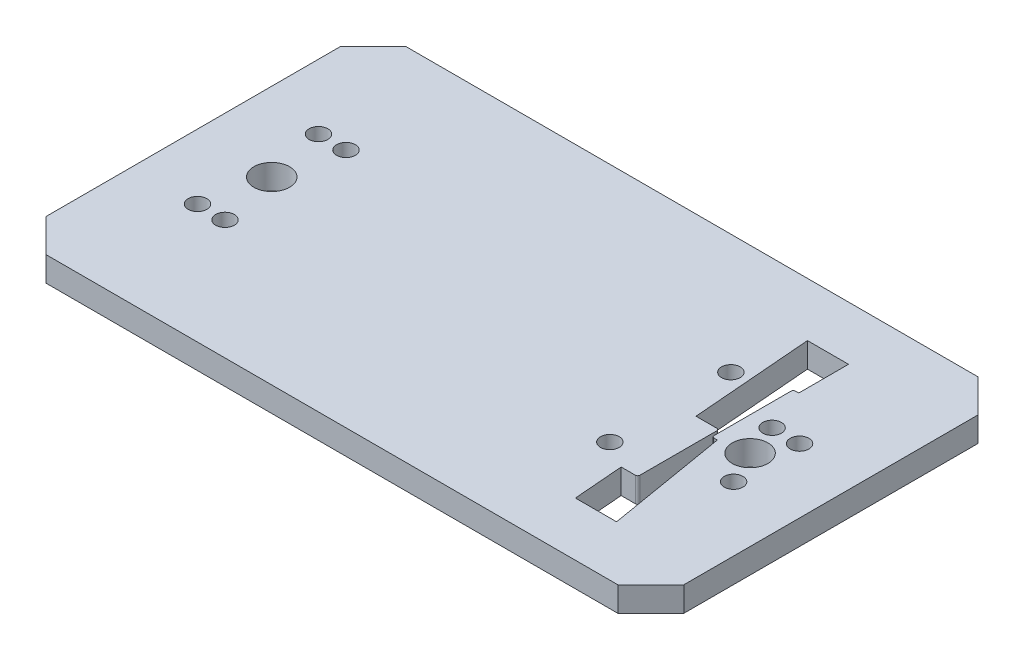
SolidWorks part; units mm, degrees
ref_plane "Front Plane" through (0, 0, 0) normal (0, 0, 1) x (1, 0, 0)
ref_plane "Top Plane" through (0, 0, 0) normal (0, 1, 0) x (1, 0, 0)
ref_plane "Right Plane" through (0, 0, 0) normal (1, 0, 0) x (0, 0, -1)
sketch "Sketch11" plane through (0, 0, 0) normal (0, 1, 0) x (1, 0, 0)
  line L0 (-47, 32.75) -> (-53, 26.75)
  line L1 (41.75, -13.5) -> (41.75, 0.5)
  line L2 (-53, 26.75) -> (-53, -26.75)
  line L3 (43.25, -0.9) -> (46.9663, -22.95)
  line L4 (-53, -26.75) -> (-47, -32.75)
  line L5 (38.7545, -13.9) -> (41.35, -13.9)
  line L7 (41.75, -26.75) -> (41.75, 26.75) construction
  line L8 (-47, -32.75) -> (57, -32.75)
  line L9 (57, -32.75) -> (63, -26.75)
  line L10 (63, -26.75) -> (63, 26.75)
  line L11 (63, 26.75) -> (57, 32.75)
  line L12 (57, 32.75) -> (-47, 32.75)
  line L13 (42.25, -0.5) -> (42.25, 13.5)
  line L14 (42.65, 13.9) -> (43.25, 13.9)
  line L15 (37.5612, 0.9) -> (35.7832, 22.95)
  line L17 (46.9663, -22.95) -> (39.4842, -22.95)
  line L18 (39.4842, -22.95) -> (38.7545, -13.9)
  line L19 (35.7832, 22.95) -> (43.25, 22.95)
  line L21 (42.25, -13.5) -> (42.25, 0.5) construction
  line L22 (41.35, 0.9) -> (37.5612, 0.9)
  line L23 (42.65, -0.9) -> (43.25, -0.9)
  line L24 (43.25, 13.9) -> (43.25, 22.95)
  line L26 (41.75, -13.5) -> (41.75, 0.5) construction
  arc A0 (42.65, -0.9) -> (42.25, -0.5) centre (42.65, -0.5) cw
  arc A1 (41.35, 0.9) -> (41.75, 0.5) centre (41.35, 0.5) cw
  circle A2 centre (-38.7, 0) radius 3.25
  arc A3 (41.75, -13.5) -> (41.35, -13.9) centre (41.35, -13.5) cw
  circle A4 centre (-41.2, 11) radius 1.7
  arc A5 (42.65, 13.9) -> (42.25, 13.5) centre (42.65, 13.5) ccw
  circle A6 centre (48.3, 0) radius 3.25
  circle A7 centre (-41.2, -11) radius 1.7
  circle A8 centre (-36.2, 11) radius 1.7
  circle A11 centre (-36.2, -11) radius 1.7
  circle A64 centre (33.8, 11) radius 1.7
  circle A67 centre (33.8, -11) radius 1.7
  circle A73 centre (46.3, 6) radius 1.7
  circle A77 centre (51.3, 6) radius 1.7
  circle A78 centre (51.3, -6) radius 1.7
  point P0 (-53, 32.75)
  point P1 (-53, -32.75)
  dimension "D3" = 21.25
  dimension "D8" = 0.4
  dimension "D7" = 0.4
  dimension "D9" = 0.4
  dimension "D6" = 0.5
extrude "Boss-Extrude4" add sketch "Sketch11" along normal blind 4.5
